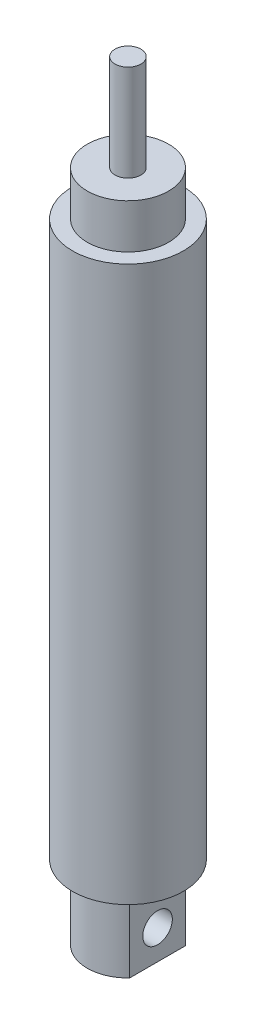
SolidWorks part; units mm, degrees
ref_plane "前视基准面" through (0, 0, 0) normal (0, 0, 1) x (1, 0, 0)
ref_plane "上视基准面" through (0, 0, 0) normal (0, 1, 0) x (1, 0, 0)
ref_plane "右视基准面" through (0, 0, 0) normal (1, 0, 0) x (0, 0, -1)
sketch "草图3" plane through (0, 0, 0) normal (0, 1, 0) x (1, 0, 0)
  line L0 (8, 7.5498) -> (8, -7.5498)
  line L1 (0, 0) -> (0, 11) construction
  line L2 (-8, 7.5498) -> (-8, -7.5498)
  arc A0 (-8, -7.5498) -> (8, -7.5498) centre (0, 0) ccw
  arc A1 (8, 7.5498) -> (-8, 7.5498) centre (0, 0) ccw
  dimension "D1" = 22
  dimension "D2" = 16
extrude "凸台-拉伸2" add sketch "草图3" along normal blind 20
sketch "草图4" plane through (8, 0, 0) normal (1, 0, 0) x (0, 0, -1)
  line L2 (-7.5498, 0) -> (7.5498, 0) construction
  circle A0 centre (0, 8) radius 4
  point P4 (0, 0)
  dimension "D1" = 8
  dimension "D2" = 4
extrude "切除-拉伸1" cut sketch "草图4" against normal blind 20
sketch "草图5" plane through (0, 20, 0) normal (0, 1, 0) x (1, 0, 0)
  circle A0 centre (0, 0) radius 15
  dimension "D1" = 30
extrude "凸台-拉伸3" add sketch "草图5" along normal blind 150
sketch "草图6" plane through (0, 170, 0) normal (0, 1, 0) x (1, 0, 0)
  circle A0 centre (0, 0) radius 11
  dimension "D1" = 22
extrude "凸台-拉伸4" add sketch "草图6" along normal blind 12
sketch "草图7" plane through (0, 182, 0) normal (0, 1, 0) x (1, 0, 0)
  circle A0 centre (0, 0) radius 3.5
  dimension "D1" = 7
extrude "凸台-拉伸5" add sketch "草图7" along normal blind 26
